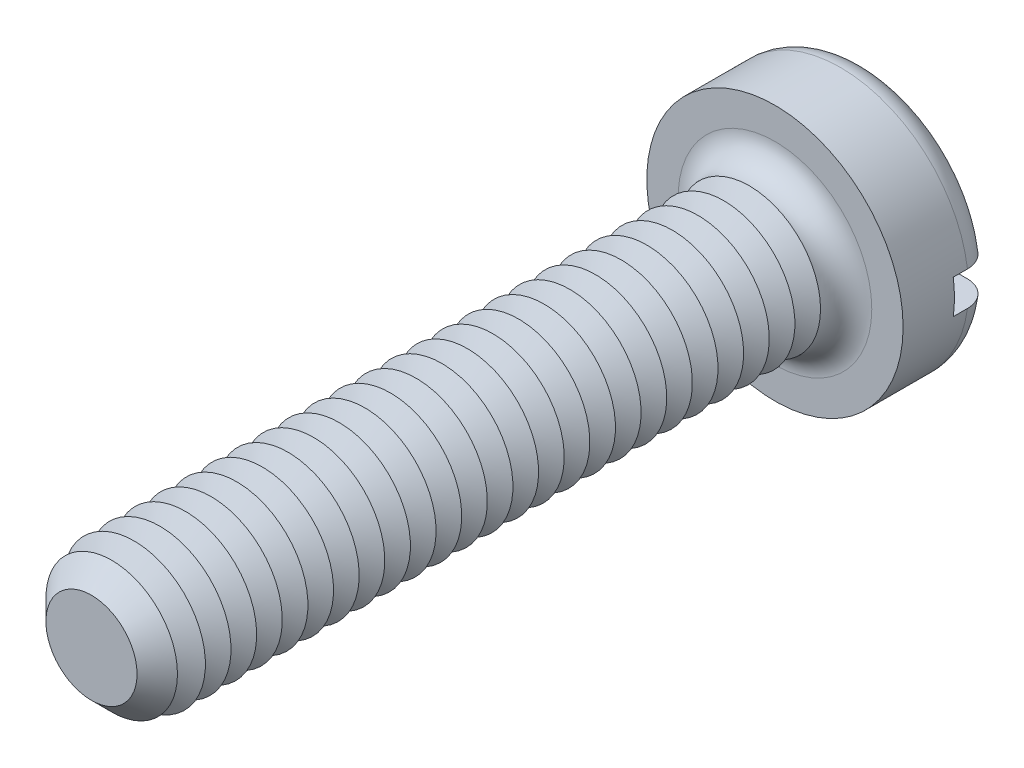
SolidWorks part; units mm, degrees
ref_plane "Front Plane" through (0, 0, 0) normal (0, 0, 1) x (1, 0, 0)
ref_plane "Top Plane" through (0, 0, 0) normal (0, 1, 0) x (1, 0, 0)
ref_plane "Right Plane" through (0, 0, 0) normal (1, 0, 0) x (0, 0, -1)
sketch "Sketch3" plane through (0, 0, 0) normal (0, 0, 1) x (1, 0, 0)
  circle A0 centre (0, 0) radius 2.25
  dimension "D1" = 4.5
extrude "Boss-Extrude2" add sketch "Sketch3" against normal blind 1.6
sketch "Sketch4" plane through (0, 0, 0) normal (0, 0, 1) x (1, 0, 0)
  circle A0 centre (0, 0) radius 1.25
  dimension "D1" = 2.5
extrude "Boss-Extrude3" add sketch "Sketch4" along normal blind 12
fillet "Fillet1" radius 0.45 2 edges at (2.25, 0, -1.6) (1.25, 0, 0)
chamfer "Chamfer1" distance 0.45 angle 45 1 edges at (1.25, 0, 12)
sketch "Sketch5" plane through (0, 0, 0) normal (1, 0, 0) x (0, 0, -1)
  line L0 (1.6944, 0) -> (-7.6738, 0) construction
sketch "Sketch6" plane through (0, 0, 0) normal (1, 0, 0) x (0, 0, -1)
  line L0 (-0.45, 1.25) -> (-0.675, 0.8603)
  line L1 (-0.675, 0.8603) -> (-0.9, 1.25)
  line L2 (-0.45, 1.25) -> (-11.55, 1.25) construction
  line L3 (-0.9, 1.25) -> (-0.45, 1.25)
  dimension "D1" = 0.45
revolve "Cut-Revolve1" cut sketch "Sketch6" angle 360 about L0
pattern_linear "LPattern1" count 25 spacing 0.45 along (0, 0, 1) of "Cut-Revolve1"
sketch "Sketch8" plane through (0, 0, -1.6) normal (0, 0, -1) x (-1, 0, 0)
  line L1 (2.25, -0.3) -> (-2.25, -0.3)
  line L2 (2.25, -0.3) -> (2.25, 0.3)
  line L3 (2.25, 0.3) -> (-2.25, 0.3)
  line L4 (-2.25, -0.3) -> (-2.25, 0.3)
  line L5 (2.25, -0.3) -> (-2.25, 0.3) construction
  line L6 (2.25, 0.3) -> (-2.25, -0.3) construction
  point P0 (0, 0)
  dimension "D1" = 4.5
  dimension "D2" = 0.6
extrude "Cut-Extrude1" cut sketch "Sketch8" against normal blind 0.7
